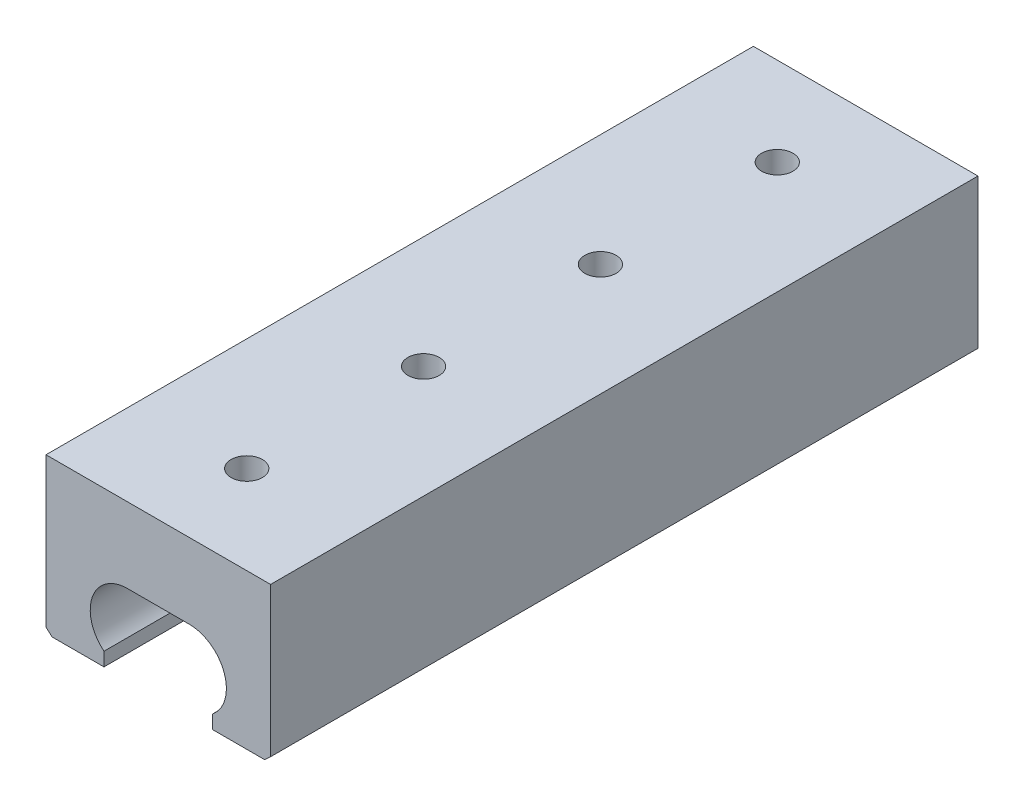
SolidWorks part; units mm, degrees
ref_plane "Front" through (0, 0, 0) normal (0, 0, 1) x (1, 0, 0)
ref_plane "Top" through (0, 0, 0) normal (0, 1, 0) x (1, 0, 0)
ref_plane "Right" through (0, 0, 0) normal (1, 0, 0) x (0, 0, -1)
sketch "Sketch1" plane through (0, 0, 0) normal (0, 0, 1) x (1, 0, 0)
  line L0 (-51.8484, -29.0299) -> (-51.8484, -32.937)
  line L1 (-68.5064, 11.513) -> (-3.9904, 11.513)
  line L2 (-20.6484, -29.0299) -> (-20.6484, -32.937)
  line L3 (-51.8484, -32.937) -> (-66.7991, -32.937)
  line L5 (-36.2484, 11.513) -> (-36.2484, -41.6818) construction
  line L6 (-45.1384, -10.0684) -> (-27.3584, -10.0684)
  line L7 (-3.9904, 11.513) -> (-3.9904, -31.3555)
  line L8 (-68.5064, 11.513) -> (-68.5064, -31.3555)
  line L9 (-20.6484, -32.937) -> (-5.6976, -32.937)
  line L11 (-68.5064, -31.3555) -> (-66.7991, -32.937)
  line L12 (-3.9904, -31.3555) -> (-5.6976, -32.937)
  arc A1 (-27.3584, -10.0684) -> (-20.6484, -29.0299) centre (-27.3584, -20.7364) cw
  arc A2 (-45.1384, -10.0684) -> (-51.8484, -29.0299) centre (-45.1384, -20.7364) ccw
  point P12 (-36.2484, -10.0684)
  dimension "D6" = 10.668
  dimension "D1" = 44.45
  dimension "D3" = 64.516
  dimension "D5" = 17.78
extrude "Base-Extrude" add sketch "Sketch1" along normal blind 203.2
sketch "Sketch2" [suppressed] plane through (0, 11.513, 0) normal (0, 1, 0) x (-1, 0, 0)
  circle A0 centre (36.2484, 177.8) radius 5.5 construction
  circle A1 centre (36.2484, 177.8) radius 5.5 construction
hole_wizard "Tap Drill for M10x1.0 Tap2" positions "Sketch4" profile "Sketch3" hole size "M10x1.0" standard "Ansi Metric"
sketch "Sketch4" plane through (0, 11.513, 0) normal (0, 1, 0) x (-1, 0, 0)
  point P0 (36.2484, 177.8)
sketch "Sketch3" plane through (-36.2484, 11.513, 177.8) normal (1, 0, 0) x (0, 0, 1)
  line L0 (0, 0) -> (0, 44.45)
  line L1 (0, 44.45) -> (4.5, 44.45)
  line L2 (4.5, 44.45) -> (4.5, 0)
  line L5 (4.5, 0) -> (0, 0)
  line L11 (0, -6.35) -> (0, 107.95) construction
  dimension "Thru Hole Dia." = 9
  dimension "Thru Hole Depth" = 44.45
pattern_linear "LPattern1" [suppressed] count 4 spacing 50.8
sketch "Sketch5" plane through (0, 11.513, 0) normal (0, 1, 0) x (-1, 0, 0)
  circle A0 centre (36.2484, 177.8) radius 5.5 construction
  circle A1 centre (36.2484, 177.8) radius 5.5 construction
hole_wizard "Tap Drill for M10x1.0 Tap1" positions "Sketch7" profile "Sketch6" hole size "M10x1.0" standard "Ansi Metric"
sketch "Sketch7" plane through (0, 11.513, 0) normal (0, 1, 0) x (-1, 0, 0)
  point P0 (36.2484, 177.8)
sketch "Sketch6" plane through (-36.2484, 11.513, 177.8) normal (1, 0, 0) x (0, 0, 1)
  line L0 (0, 0) -> (0, 44.45)
  line L1 (0, 44.45) -> (4.5, 44.45)
  line L2 (4.5, 44.45) -> (4.5, 0)
  line L5 (4.5, 0) -> (0, 0)
  line L11 (0, -6.35) -> (0, 107.95) construction
  dimension "Thru Hole Dia." = 9
  dimension "Thru Hole Depth" = 44.45
pattern_linear "LPattern2" count 4 spacing 50.8 along (0, 0, -1) of "Tap Drill for M10x1.0 Tap1"
